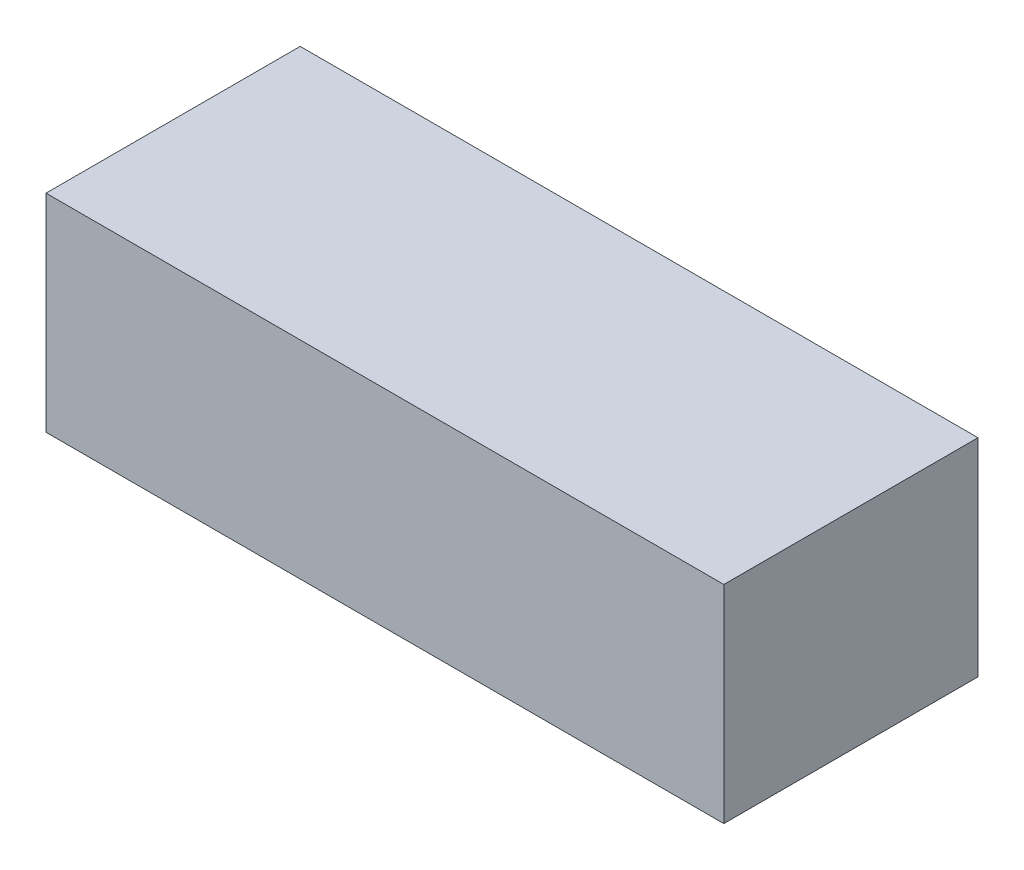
SolidWorks part; units mm, degrees
ref_plane "Front Plane" through (0, 0, 0) normal (0, 0, 1) x (1, 0, 0)
ref_plane "Top Plane" through (0, 0, 0) normal (0, 1, 0) x (1, 0, 0)
ref_plane "Right Plane" through (0, 0, 0) normal (1, 0, 0) x (0, 0, -1)
sketch "Sketch1" plane through (0, 0, 0) normal (0, 0, 1) x (1, 0, 0)
  line L1 (0, 0) -> (36, 0)
  line L2 (0, 0) -> (0, 11)
  line L3 (0, 11) -> (36, 11)
  line L4 (36, 0) -> (36, 11)
extrude "Boss-Extrude1" add sketch "Sketch1" along normal blind 13.5 contours L1 L4 L3 L2
equation "\"sheetThickness\"=0.63mm"
equation "\"flange\"= 11mm"
equation "\"baffleCutWidth\"= 28.58mm"
equation "\"baffleCutLength\"= 146.22mm"
equation "\"metalLength\" = 156.28mm"
equation "\"metalWidth\" = 35.5mm"
equation "\"pitch\" = 42mm"
equation "\"cabDepth\" = 130mm "
equation "\"D1@Sketch1\"=\"pitch\"-6"
equation "\"D2@Sketch1\"=\"flange\""
